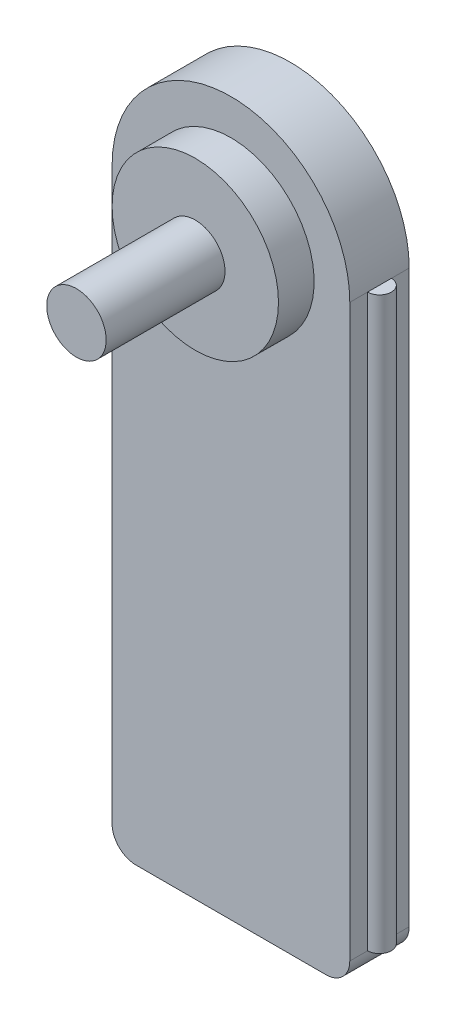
SolidWorks part; units mm, degrees
ref_plane "前视基准面" through (0, 0, 0) normal (0, 0, 1) x (1, 0, 0)
ref_plane "上视基准面" through (0, 0, 0) normal (0, 1, 0) x (1, 0, 0)
ref_plane "右视基准面" through (0, 0, 0) normal (1, 0, 0) x (0, 0, -1)
sketch "草图1" plane through (0, 0, 0) normal (0, 0, 1) x (1, 0, 0)
  line L0 (-10, 0) -> (-10, -48)
  line L1 (-8, -50) -> (8, -50)
  line L2 (10, -48) -> (10, 0)
  arc A0 (-10, 0) -> (10, 0) centre (0, 0) cw
  arc A1 (8, -50) -> (10, -48) centre (8, -48) ccw
  arc A2 (-10, -48) -> (-8, -50) centre (-8, -48) ccw
  point P8 (10, -50)
  dimension "D1" = 10
  dimension "D3" = 2
  dimension "D2" = 50
extrude "凸台-拉伸1" add sketch "草图1" along normal blind 5
sketch "草图2" plane through (0, 0, 5) normal (0, 0, 1) x (1, 0, 0)
  circle A0 centre (0, 0) radius 7
  dimension "D1" = 14
extrude "凸台-拉伸2" add sketch "草图2" along normal blind 3
sketch "草图3" plane through (0, 0, 8) normal (0, 0, 1) x (1, 0, 0)
  circle A0 centre (0, 0) radius 2.5
  dimension "D1" = 5
extrude "凸台-拉伸3" add sketch "草图3" along normal blind 10
sketch "草图4" plane through (0, 0, 0) normal (0, 1, 0) x (1, 0, 0)
  line L0 (-12.5355, -2.5) -> (13.3978, -2.5) construction
  line L1 (10, -5) -> (10, 0) construction
  circle A0 centre (10, -2.5) radius 1
  dimension "D2" = 2
  dimension "D1" = 2.5
extrude "凸台-拉伸4" add sketch "草图4" against normal up to vertex (48 mm away)
mirror "镜向1" about plane through (0, 0, 0) normal (1, 0, 0) of "凸台-拉伸4"
